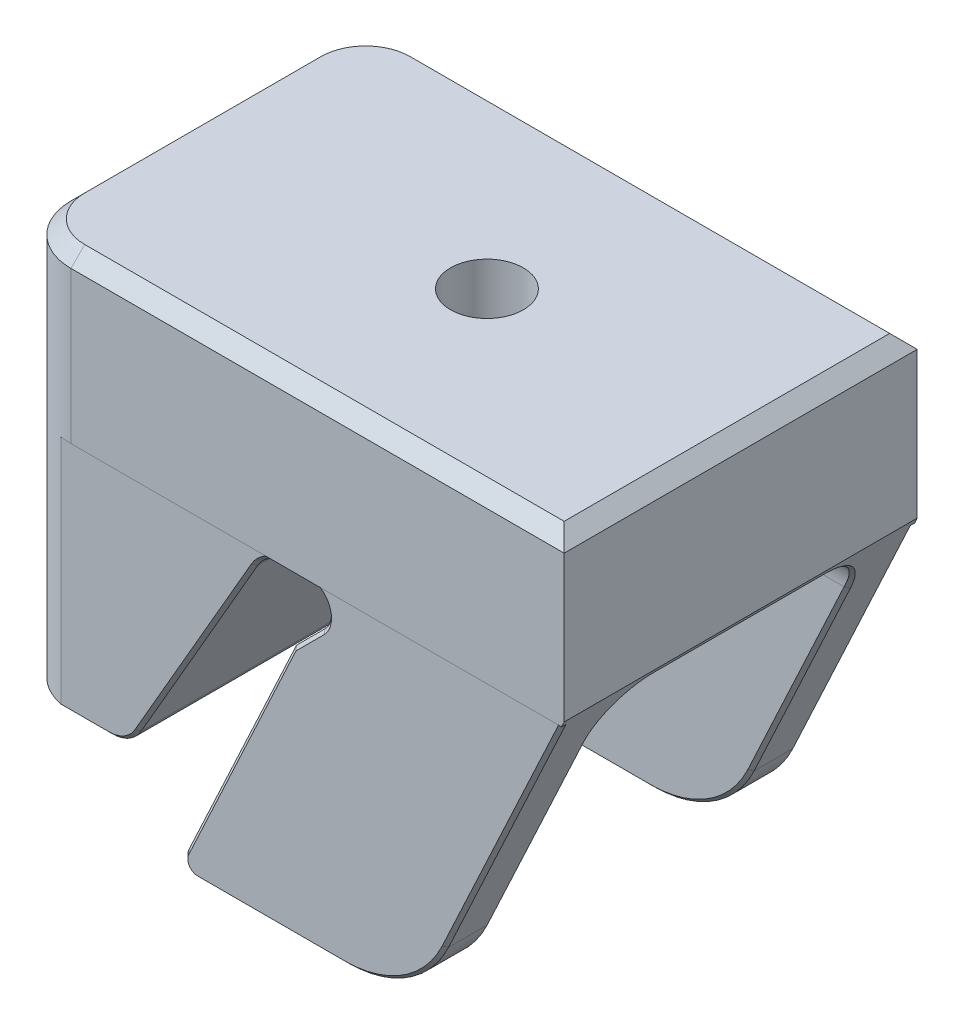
SolidWorks part; units mm, degrees
ref_plane "Front Plane" through (0, 0, 0) normal (0, 0, 1) x (1, 0, 0)
ref_plane "Top Plane" through (0, 0, 0) normal (0, 1, 0) x (1, 0, 0)
ref_plane "Right Plane" through (0, 0, 0) normal (1, 0, 0) x (0, 0, -1)
sketch "Sketch1" plane through (0, 0, 0) normal (0, 0, 1) x (1, 0, 0)
  line L0 (0, 0) -> (50, 0)
  line L1 (17.7784, 0) -> (-17.7784, 0) construction
  line L2 (50, 0) -> (50, -43.6)
  line L3 (50, -43.6) -> (16.6872, -43.6)
  line L4 (0, -36.3) -> (0, 0)
  line L5 (15.5997, -41.8929) -> (25.3422, -21)
  line L6 (22.69, -15) -> (11.2585, -34.8)
  line L7 (22.69, -15) -> (26.5137, -15)
  line L8 (8.6604, -36.3) -> (0, -36.3)
  line L9 (25.3422, -21) -> (27.9279, -18.4142)
  arc A0 (15.5997, -41.8929) -> (16.6872, -43.6) centre (16.6872, -42.4) ccw
  arc A1 (11.2585, -34.8) -> (8.6604, -36.3) centre (8.6604, -33.3) cw
  arc A2 (27.9279, -18.4142) -> (26.5137, -15) centre (26.5137, -17) ccw
  point P9 (28.14, -15)
  dimension "D8" = 1.2
  dimension "D5" = 28.14
  dimension "D10" = 3
  dimension "D11" = 4
  dimension "D1" = 50
  dimension "D2" = 43.6
  dimension "D3" = 30
  dimension "D4" = 25
  dimension "D6" = 36.3
  dimension "D7" = 15
  dimension "D9" = 22.69
  dimension "D12" = 20
  dimension "D13" = 21
extrude "Boss-Extrude1" add sketch "Sketch1" along normal mid plane 32
sketch "Sketch2" plane through (50, 0, 0) normal (1, 0, 0) x (0, 0, -1)
  line L2 (11.8, -43.6) -> (11.8, -19)
  line L3 (-16, -43.6) -> (16, -43.6) construction
  line L4 (7.8, -15) -> (-7.8, -15)
  line L5 (-11.8, -19) -> (-11.8, -43.6)
  line L6 (-11.8, -43.6) -> (11.8, -43.6)
  arc A0 (11.8, -19) -> (7.8, -15) centre (7.8, -19) ccw
  arc A1 (-11.8, -19) -> (-7.8, -15) centre (-7.8, -19) cw
  dimension "D4" = 4
  dimension "D1" = 15
  dimension "D2" = 11.8
  dimension "D3" = 11.8
fillet "Fillet1" radius 5.3 2 edges at (0, -18.15, -16) (0, -18.15, 16)
extrude "Cut-Extrude2" cut sketch "Sketch2" against normal up to surface (43.8222 mm away)
sketch "Sketch3" plane through (0, 0, 16) normal (0, 0, 1) x (1, 0, 0)
  line L1 (50, -14.5) -> (36.4304, -43.6)
  line L2 (50, -14.5) -> (50, -43.6)
  line L3 (16.6872, -43.6) -> (50, -43.6) construction
  line L4 (50, -43.6) -> (50, 0) construction
  line L6 (50, -43.6) -> (36.4304, -43.6)
  dimension "D1" = 14.5
  dimension "D2" = 25
extrude "Cut-Extrude3" cut sketch "Sketch3" against normal through all
fillet "Fillet2" radius 10 2 edges at (36.4304, -43.6, -13.9) (36.4304, -43.6, 13.9)
fillet "Fillet3" radius 3 1 edges at (22.69, -15, 0)
fillet "Fillet4" [suppressed] radius 1
chamfer "Chamfer1" distance 1.25 angle 45 6 edges at (27.65, 0, 16) (1.5523, 0, 14.4477) (0, 0, 0) (1.5523, 0, -14.4477) (27.65, 0, -16) (50, 0, 0)
sketch "Sketch5" plane through (0, 0, 0) normal (0, 0, 1) x (1, 0, 0)
  line L0 (27, 0.9972) -> (27, -12.6001) construction
  line L1 (32.5, -18.2) -> (32.5, -8.2)
  line L2 (32.5, -8.2) -> (30.3, -8.2)
  line L3 (30.3, -8.2) -> (30.3, 0)
  line L4 (27, -18.2) -> (27, 0)
  line L5 (27, 0) -> (30.3, 0)
  line L7 (5.3, 0) -> (48.75, 0) construction
  line L8 (27, -18.2) -> (32.5, -18.2)
  dimension "D1" = 27
  dimension "D2" = 8.2
  dimension "D3" = 3.3
  dimension "D4" = 5.5
  dimension "D5" = 10
revolve "Cut-Revolve1" cut sketch "Sketch5" angle 360 about L0
chamfer "Chamfer3" distance 0.3 angle 45 13 edges at (20.4709, -31.4464, 11.8) (15.6752, -43.0448, 11.8) (23.3735, -43.6, 11.8) (35.4327, -42.0339, 11.8) (20.4709, -31.4464, -11.8) (43.5122, -28.4131, 11.8) (15.6752, -43.0448, -11.8) (49.2205, -16.1716, 10.6284) (23.3735, -43.6, -11.8) (35.4327, -42.0339, -11.8) (49.2205, -16.1716, -10.6284) (43.5122, -28.4131, -11.8) (49.7668, -15, 0)
ref_plane "Plane1" through (10.3, 0, 0) normal (1, 0, 0) x (0, 0, -1)
sketch "Sketch6" plane through (0, 0, 0) normal (0, 0, 1) x (1, 0, 0)
  line L0 (11.2585, -34.8) -> (21.824, -16.5) construction
  line L1 (5.3, 0) -> (48.75, 0) construction
  line L2 (50, -14.5) -> (39.1228, -37.8262) construction
  line L3 (0, -36.3) -> (0, -1.25) construction
  circle A0 centre (22.69, -5) radius 5
  circle A1 centre (48.913, -5) radius 5
  dimension "D1" = 10
  dimension "D2" = 10
  dimension "D3" = 43.913
  dimension "D4" = 17.69
ref_plane "Plane2" through (15.3, 0, 0) normal (1, 0, 0) x (0, 0, -1)
sketch "Sketch7" plane through (0, 0, 16) normal (0, 0, 1) x (1, 0, 0)
  line L1 (3, -45) -> (50, -45)
  line L2 (3, -45) -> (3, -15)
  line L3 (3, -15) -> (50, -15)
  line L4 (50, -15) -> (50, -45)
  line L5 (26.5137, -15) -> (49.5757, -15) construction
  line L8 (50, -14.5) -> (50, -1.25) construction
  dimension "D1" = 47
  dimension "D2" = 30
extrude "Cut-Extrude4" cut sketch "Sketch7" against normal blind 0.1
mirror "Mirror1" about plane through (0, 0, 0) normal (0, 0, 1) of "Cut-Extrude4"
sketch "Sketch8" plane through (0, 0, 0) normal (0, 0, 1) x (1, 0, 0)
  line L0 (5.3, -15) -> (49.7668, -15) construction
  line L1 (0, -36.3) -> (0.1, -36.3)
  line L2 (0, -36.3) -> (0, -15)
  line L3 (0, -15) -> (0.1, -15)
  line L4 (0.1, -36.3) -> (0.1, -15)
  dimension "D1" = 0.1
extrude "Cut-Extrude5" cut sketch "Sketch8" against normal mid plane 30
chamfer "Chamfer5" distance 0.3 angle 45 25 edges at (22.9221, -15.4019, -15.9) (6.4678, -36.3, -15.9) (16.5412, -25.65, -15.9) (10.1604, -35.8981, -15.9) (22.9221, -15.4019, 15.9) (16.5412, -25.65, 15.9) (6.4678, -36.3, 15.9) (10.1604, -35.8981, 15.9) (1.5523, -36.3, -14.4477) (1.5523, -36.3, 14.4477) (20.4709, -31.4464, 15.9) (15.6752, -43.0448, 15.9) (23.3735, -43.6, 15.9) (44.4448, -26.4131, 15.9) (35.4327, -42.0339, 15.9) (20.4709, -31.4464, -15.9) (15.6752, -43.0448, -15.9) (23.3735, -43.6, -15.9) (35.4327, -42.0339, -15.9) (44.4448, -26.4131, -15.9) (0.1, -36.3, 0) (26.635, -19.7071, -15.9) (28.3615, -16.2346, -15.9) (28.3615, -16.2346, 15.9) (26.635, -19.7071, 15.9)
